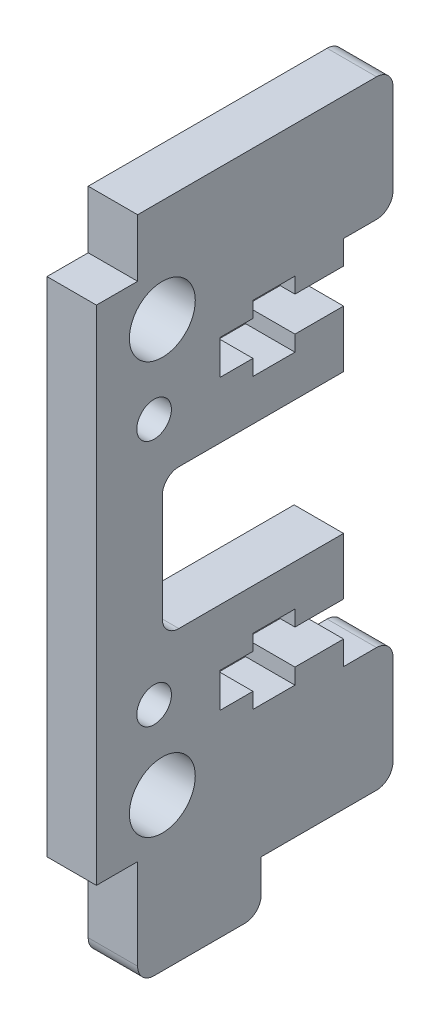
SolidWorks part; units mm, degrees
ref_plane "Спереди" through (0, 0, 0) normal (0, 0, 1) x (1, 0, 0)
ref_plane "Сверху" through (0, 0, 0) normal (0, 1, 0) x (1, 0, 0)
ref_plane "Справа" through (0, 0, 0) normal (1, 0, 0) x (0, 0, -1)
sketch "Эскиз1" plane through (0, 0, 0) normal (1, 0, 0) x (0, 0, -1)
  line L0 (0, 37.5) -> (-19.3069, 37.5) construction
  line L1 (0, 0) -> (30, 0)
  line L2 (0, 0) -> (0, 75)
  line L3 (0, 75) -> (30, 75)
  line L4 (30, 0) -> (30, 75)
  line L5 (30, 75) -> (34, 75)
  line L6 (30, 75) -> (30, 60)
  line L7 (30, 60) -> (34, 60)
  line L8 (36, 73) -> (36, 62)
  line L9 (30, 0) -> (34, 0)
  line L10 (30, 0) -> (30, 15)
  line L11 (30, 15) -> (34, 15)
  line L12 (36, 2) -> (36, 13)
  line L13 (30, 57.1) -> (15, 57.1)
  line L14 (30, 57.1) -> (30, 52.9)
  line L15 (30, 52.9) -> (15, 52.9)
  line L16 (15, 57.1) -> (15, 52.9)
  line L17 (19, 59) -> (24.1, 59)
  line L18 (19, 59) -> (19, 51)
  line L19 (19, 51) -> (24.1, 51)
  line L20 (24.1, 59) -> (24.1, 51)
  line L21 (30, 22.1) -> (15, 22.1)
  line L22 (30, 22.1) -> (30, 17.9)
  line L23 (30, 17.9) -> (15, 17.9)
  line L24 (15, 22.1) -> (15, 17.9)
  line L25 (19, 24) -> (24.1, 24)
  line L26 (19, 24) -> (19, 16)
  line L27 (19, 16) -> (24.1, 16)
  line L28 (24.1, 24) -> (24.1, 16)
  line L30 (0, 75) -> (5, 75)
  line L31 (0, 75) -> (0, 68)
  line L32 (0, 68) -> (5, 68)
  line L33 (5, 75) -> (5, 68)
  line L35 (5, 72) -> (5, 75)
  line L36 (5, 75) -> (11, 75)
  line L38 (5, 0) -> (11, 0)
  line L39 (5, 3) -> (5, 0)
  line L41 (5, 0) -> (5, 7)
  line L42 (0, 7) -> (5, 7)
  line L43 (0, 0) -> (0, 7)
  line L44 (0, 0) -> (5, 0)
  circle A0 centre (8, 62.5) radius 4
  circle A1 centre (7, 52.5) radius 2.1
  circle A2 centre (7, 22.5) radius 2.1
  circle A3 centre (8, 12.5) radius 4
  arc A4 (34, 15) -> (36, 13) centre (34, 13) cw
  arc A5 (34, 0) -> (36, 2) centre (34, 2) ccw
  arc A6 (34, 75) -> (36, 73) centre (34, 73) cw
  arc A7 (36, 62) -> (34, 60) centre (34, 62) cw
  point P27 (15, 55)
  point P28 (19, 55)
  point P29 (15, 20)
  point P30 (19, 20)
  point P43 (36, 15)
  point P46 (36, 0)
  point P49 (36, 75)
  point P52 (36, 60)
  dimension "D19" = 8
  dimension "D22" = 4.2
  dimension "D25" = 2
  dimension "D1" = 30
  dimension "D2" = 75
  dimension "D3" = 15
  dimension "D4" = 6
  dimension "D5" = 15
  dimension "D6" = 6
  dimension "D7" = 4.2
  dimension "D8" = 8
  dimension "D9" = 5.1
  dimension "D10" = 4
  dimension "D11" = 15
  dimension "D12" = 5
  dimension "D13" = 4.2
  dimension "D14" = 8
  dimension "D15" = 4
  dimension "D16" = 5.1
  dimension "D17" = 15
  dimension "D18" = 5
  dimension "D20" = 8
  dimension "D21" = 25
  dimension "D23" = 10
  dimension "D24" = 7
  dimension "D26" = 5
  dimension "D29" = 7
extrude "Бобышка-Вытянуть1" add sketch "Эскиз1" along normal blind 6 contours L9 A5 L12 A4 L11 L4 | A7 L8 A6 L5 L4 L7 | L25 L28 L21 L4 L15 L20 L19 L18 L16 L13 L17 L3 L2 L1 L23 L27 L26 L24 A2 A1 A0 A3
sketch "Эскиз2" plane through (6, 0, 0) normal (1, 0, 0) x (0, 0, -1)
  line L0 (30, 22.1) -> (30, 52.9) construction
  line L1 (30, 46) -> (10, 46)
  line L2 (30, 46) -> (30, 29)
  line L3 (30, 29) -> (10, 29)
  line L4 (8, 44) -> (8, 31)
  line L5 (19, 51) -> (24.1, 51) construction
  line L6 (19, 24) -> (24.1, 24) construction
  arc A0 (10, 29) -> (8, 31) centre (10, 31) cw
  arc A1 (10, 46) -> (8, 44) centre (10, 44) ccw
  point P6 (21.55, 51)
  point P9 (21.55, 24)
  dimension "D4" = 2
  dimension "D1" = 5
  dimension "D2" = 5
  dimension "D3" = 22
extrude "Вырез-Вытянуть1" cut sketch "Эскиз2" against normal through all
sketch "Эскиз3" plane through (6, 0, 0) normal (1, 0, 0) x (0, 0, -1)
  line L0 (5, 0) -> (34, 0) construction
  line L1 (5, 0) -> (20, 0)
  line L2 (5, 0) -> (5, -4)
  line L3 (7, -6) -> (18, -6)
  line L4 (20, 0) -> (20, -4)
  arc A0 (18, -6) -> (20, -4) centre (18, -4) ccw
  arc A1 (5, -4) -> (7, -6) centre (7, -4) ccw
  point P9 (20, -6)
  point P12 (5, -6)
  dimension "D4" = 2
  dimension "D1" = 6
  dimension "D2" = 15
  dimension "D3" = 5
extrude "Бобышка-Вытянуть2" add sketch "Эскиз3" against normal up to surface (6 mm away)
